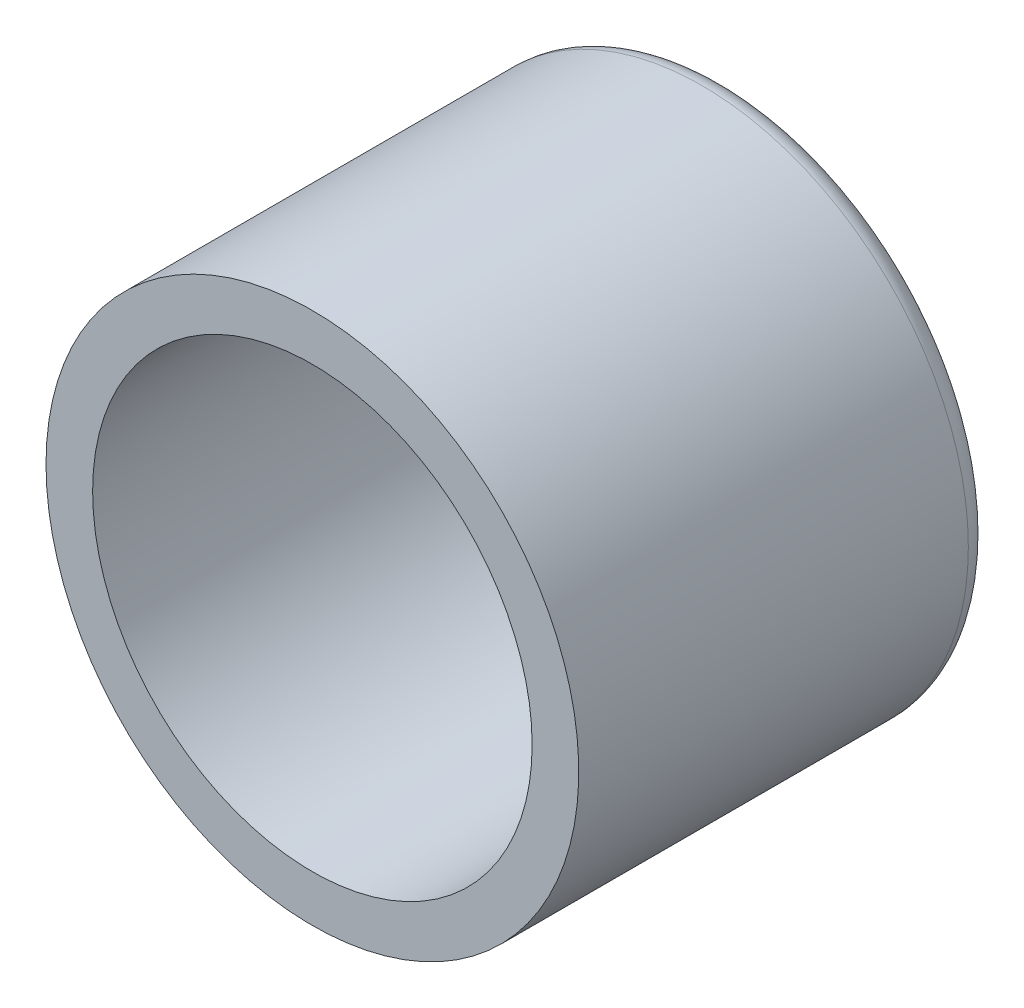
SolidWorks part; units mm, degrees
ref_plane "Alzado" through (0, 0, 0) normal (0, 0, 1) x (1, 0, 0)
ref_plane "Planta" through (0, 0, 0) normal (0, 1, 0) x (1, 0, 0)
ref_plane "Vista lateral" through (0, 0, 0) normal (1, 0, 0) x (0, 0, -1)
sketch "cercles" plane through (0, 0, 0) normal (0, 0, 1) x (1, 0, 0)
  circle A0 centre (0, 0) radius 8
  circle A1 centre (0, 0) radius 6.6
extrude "Cylindre" add sketch "cercles" along normal blind 12.4
fillet "congé" radius 0.7 1 edges at (8, 0, 0)
sketch "Esquisse1" plane through (0, 0, 0) normal (0, 0, 1) x (1, 0, 0)
  circle A0 centre (0, 0) radius 6.6
extrude "grille" add sketch "Esquisse1" along normal blind 0.2
